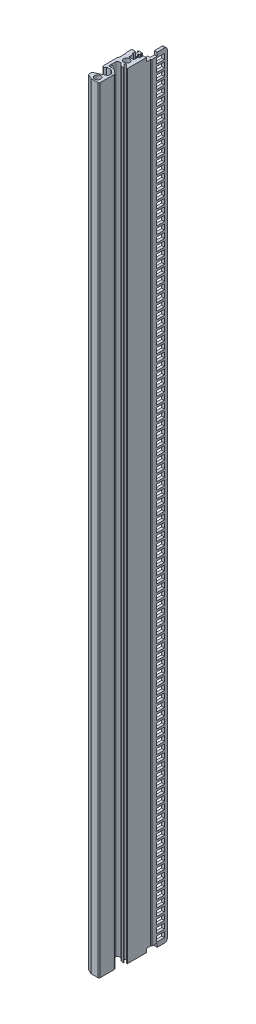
SolidWorks part; units mm, degrees
ref_plane "前视基准面" through (0, 0, 0) normal (0, 0, 1) x (1, 0, 0)
ref_plane "上视基准面" through (0, 0, 0) normal (0, 1, 0) x (1, 0, 0)
ref_plane "右视基准面" through (0, 0, 0) normal (1, 0, 0) x (0, 0, -1)
sketch "草图1" plane through (0, 0, 0) normal (0, 1, 0) x (1, 0, 0)
  line L0 (-4.2, 11.9) -> (-3.9, 11.9)
  line L1 (-4.4, 12.2) -> (-4.4, 12.1)
  line L2 (-4.0328, 12.4) -> (-4.2, 12.4)
  line L3 (-3.85, 12.5) -> (-3.8914, 12.4586)
  line L4 (-2.05, 12.5) -> (-3.85, 12.5)
  line L5 (-2.0086, 12.4586) -> (-2.05, 12.5)
  line L6 (-1.7, 12.4) -> (-1.8672, 12.4)
  line L7 (-1.5, 12.1) -> (-1.5, 12.2)
  line L8 (-1.8, 11.9) -> (-1.7, 11.9)
  line L9 (-2, 11.4828) -> (-2, 11.7)
  line L10 (-1.3586, 10.7586) -> (-1.9414, 11.3414)
  line L11 (-1.3, 10.55) -> (-1.3, 10.6172)
  line L12 (-3.7, 11.7) -> (-3.7, 9.95)
  line L13 (-5, -10.75) -> (-5, -1.6)
  line L14 (-3, -9.35) -> (-3, -5.75)
  line L16 (1.6887, -3.3855) -> (3.2118, -4.9086)
  line L17 (2.5373, -2.537) -> (4.6586, -4.6583)
  line L18 (5, 15) -> (5, 5.1793)
  line L19 (3.6, 15) -> (5, 15)
  line L20 (3.6, 12.5) -> (3.6, 15)
  line L21 (1.95, 12.5) -> (3.6, 12.5)
  line L22 (1.95, 10.55) -> (1.95, 12.5)
  line L23 (2.85, 10.55) -> (1.95, 10.55)
  line L24 (2.85, 9.35) -> (2.85, 10.55)
  line L25 (1.95, 9.35) -> (2.85, 9.35)
  line L26 (1.95, 8.35) -> (1.95, 9.35)
  line L27 (2.85, 8.35) -> (1.95, 8.35)
  line L28 (2.85, 6.05) -> (2.85, 8.35)
  line L29 (1.95, 6.05) -> (2.85, 6.05)
  line L30 (1.95, 3.8856) -> (1.95, 6.05)
  line L31 (-1.45, 6.05) -> (-1.45, 2.9458)
  line L32 (-2.35, 6.05) -> (-1.45, 6.05)
  line L33 (-2.35, 8.35) -> (-2.35, 6.05)
  line L34 (-1.45, 8.35) -> (-2.35, 8.35)
  line L35 (-1.45, 9.35) -> (-1.45, 8.35)
  line L36 (-2.35, 9.35) -> (-1.45, 9.35)
  line L37 (-2.35, 10.55) -> (-2.35, 9.35)
  line L38 (-1.3, 10.55) -> (-2.35, 10.55)
  line L39 (-4.45, 7.7) -> (-4.7, 7.7)
  line L40 (-5, 7.4) -> (-4.7, 7.7)
  line L41 (-5, 4.4) -> (-5, 7.4)
  line L42 (-4.5499, 3.8998) -> (-5, 4.4)
  line L43 (-4.45, 7.7) -> (-4.45, 9.55)
  line L44 (-3.9, 9.75) -> (-4.25, 9.75)
  line L45 (-4.5499, 3.8998) -> (-4.5501, -1.1002)
  line L46 (-5, -1.6) -> (-4.5501, -1.1002)
  line L47 (4.9414, -1.9395) -> (4.6464, -1.6446) construction
  line L48 (5, -2.081) -> (5, -4.5169)
  line L49 (0, 0) -> (0, -5) construction
  line L50 (4.5, -1.291) -> (4.5, 4.3894) construction
  line L53 (-2.5, -5.25) -> (3.0703, -5.25)
  line L54 (2.5373, -2.537) -> (1.6887, -3.3855) construction
  line L55 (5, 5.1793) -> (5, -2.081)
  line L58 (4.9414, 5.0379) -> (4.6464, 4.743) construction
  line L121 (-3, -9.35) -> (4, -9.35)
  line L122 (-4.2, -17.25) -> (2.6, -17.25)
  line L123 (-5, -22.2) -> (-5, -18.05)
  line L124 (-3, -10.75) -> (2.6, -10.75)
  line L125 (4, -9.35) -> (4, -22.2)
  line L126 (3.2, -23) -> (-4.2, -23)
  line L127 (2.6, -10.75) -> (2.6, -17.25)
  circle A0 centre (0, 0) radius 1.6
  arc A1 (-4.4, 12.1) -> (-4.2, 11.9) centre (-4.2, 12.1) ccw
  arc A2 (-4.2, 12.4) -> (-4.4, 12.2) centre (-4.2, 12.2) ccw
  arc A3 (-4.0328, 12.4) -> (-3.8914, 12.4586) centre (-4.0328, 12.6) ccw
  arc A4 (-2.0086, 12.4586) -> (-1.8672, 12.4) centre (-1.8672, 12.6) ccw
  arc A5 (-1.5, 12.2) -> (-1.7, 12.4) centre (-1.7, 12.2) ccw
  arc A6 (-1.7, 11.9) -> (-1.5, 12.1) centre (-1.7, 12.1) ccw
  arc A7 (-1.8, 11.9) -> (-2, 11.7) centre (-1.8, 11.7) ccw
  arc A8 (-2, 11.4828) -> (-1.9414, 11.3414) centre (-1.8, 11.4828) ccw
  arc A9 (-1.3, 10.6172) -> (-1.3586, 10.7586) centre (-1.5, 10.6172) ccw
  arc A11 (3.0703, -5.25) -> (3.2118, -4.9086) centre (3.0703, -5.05) ccw
  arc A12 (-4.25, 9.75) -> (-4.45, 9.55) centre (-4.25, 9.55) ccw
  arc A13 (-3.9, 9.75) -> (-3.7, 9.95) centre (-3.9, 9.95) ccw
  arc A14 (5, -2.081) -> (4.9414, -1.9395) centre (4.8, -2.081) ccw construction
  arc A15 (4.9414, 5.0379) -> (5, 5.1793) centre (4.8, 5.1793) ccw construction
  arc A16 (4.6586, -4.6583) -> (5, -4.5169) centre (4.8, -4.5169) ccw
  arc A17 (2.5373, -2.537) -> (1.6887, -3.3855) centre (2.113, -2.9613) ccw
  arc A18 (0.7125, 2.9142) -> (-1.1719, 2.7616) centre (0, 0) ccw
  arc A19 (-1.45, 2.9458) -> (-1.1719, 2.7616) centre (-1.25, 2.9458) ccw
  arc A20 (0.7125, 2.9142) -> (1.95, 3.8856) centre (0.95, 3.8856) ccw
  arc A21 (-3.7, 11.7) -> (-3.9, 11.9) centre (-3.9, 11.7) ccw
  arc A22 (4.6464, -1.6446) -> (4.5, -1.291) centre (5, -1.291) cw construction
  arc A23 (4.5, 4.3894) -> (4.6464, 4.743) centre (5, 4.3894) cw construction
  arc A29 (-3, -5.75) -> (-2.5, -5.25) centre (-2.5, -5.75) cw
  arc A60 (-5, -22.2) -> (-4.2, -23) centre (-4.2, -22.2) ccw
  circle A61 centre (0, -20) radius 1.6
  arc A62 (-4.2, -17.25) -> (-5, -18.05) centre (-4.2, -18.05) ccw
  arc A63 (-5, -10.75) -> (-3, -10.75) centre (-4, -10.75) ccw
  arc A64 (3.2, -23) -> (4, -22.2) centre (3.2, -22.2) ccw
  dimension "D1" = 3.2
  dimension "D3" = 5.2
  dimension "D4" = 45
  dimension "D5" = 1.2
  dimension "D7" = 0.6
  dimension "D8" = 0.2
  dimension "D10" = 4.1
  dimension "D11" = 1.4
  dimension "D12" = 0.5
  dimension "D13" = 0.5
  dimension "D14" = 1
  dimension "D33" = 3.2
  dimension "D34" = 20
  dimension "D37" = 0.8
  dimension "D38" = 0.8
  dimension "D39" = 0.8
  dimension "D6" = 3
  dimension "D9" = 2.1225
  dimension "D28" = 38
  dimension "D29" = 13.65
  dimension "D30" = 1
  dimension "D31" = 9
  dimension "D32" = 5.75
  dimension "D36" = 6.5
extrude "凸台-拉伸1" add sketch "草图1" along normal mid plane 533.4
sketch "草图6" plane through (0, 266.7, 0) normal (0, 1, 0) x (1, 0, 0)
  line L0 (3.6, 12.5) -> (3.6, 22.5)
  line L1 (3.6, 22.5) -> (5.5, 22.5)
  line L2 (5.5, 22.5) -> (5.5, 12)
  line L3 (5.5, 12) -> (5, 11.5)
  line L4 (3.6, 12.5) -> (5, 11.5)
  line L5 (5, -4.5169) -> (5, 15) construction
  line L6 (-5, 7.4) -> (-5, 4.4) construction
  dimension "D4" = 11
  dimension "D1" = 10.5
  dimension "D2" = 10
  dimension "D3" = 45
extrude "凸台-拉伸2" add sketch "草图6" against normal up to surface (533.4 mm away)
sketch "草图2" plane through (0, 266.7, 0) normal (0, 1, 0) x (1, 0, 0)
  circle A0 centre (0, 0) radius 2.1
  circle A1 centre (0, -20) radius 2.1
  dimension "D1" = 4.2
  dimension "D2" = 4.2
extrude "切除-拉伸1" cut sketch "草图2" against normal blind 10
sketch "草图3" plane through (0, -266.7, 0) normal (0, -1, 0) x (1, 0, 0)
  circle A0 centre (0, 0) radius 2.1
  circle A1 centre (0, 20) radius 2.1
  dimension "D1" = 4.2
  dimension "D2" = 4.2
extrude "切除-拉伸2" cut sketch "草图3" against normal blind 10
sketch "草图4" plane through (-5, 0, 0) normal (-1, 0, 0) x (0, 0, 1)
  line L0 (1.6, -266.7) -> (10.75, -266.7) construction
  line L2 (11.75, -266.7) -> (11.75, 266.7) construction
  circle A0 centre (7.5, -264.16) radius 1.65
  circle A1 centre (7.5, -259.08) radius 1.65
  circle A2 centre (7.5, -254) radius 1.65
  circle A3 centre (7.5, -248.92) radius 1.65
  circle A4 centre (7.5, -243.84) radius 1.65
  circle A5 centre (7.5, -238.76) radius 1.65
  circle A6 centre (7.5, -233.68) radius 1.65
  circle A7 centre (7.5, -228.6) radius 1.65
  circle A8 centre (7.5, -223.52) radius 1.65
  circle A9 centre (7.5, -218.44) radius 1.65
  circle A10 centre (7.5, -213.36) radius 1.65
  circle A11 centre (7.5, -208.28) radius 1.65
  circle A12 centre (7.5, -203.2) radius 1.65
  circle A13 centre (7.5, -198.12) radius 1.65
  circle A14 centre (7.5, -193.04) radius 1.65
  circle A15 centre (7.5, -187.96) radius 1.65
  circle A16 centre (7.5, -182.88) radius 1.65
  circle A17 centre (7.5, -177.8) radius 1.65
  circle A18 centre (7.5, -172.72) radius 1.65
  circle A19 centre (7.5, -167.64) radius 1.65
  circle A20 centre (7.5, -162.56) radius 1.65
  circle A21 centre (7.5, -157.48) radius 1.65
  circle A22 centre (7.5, -152.4) radius 1.65
  circle A23 centre (7.5, -147.32) radius 1.65
  circle A24 centre (7.5, -142.24) radius 1.65
  circle A25 centre (7.5, -137.16) radius 1.65
  circle A26 centre (7.5, -132.08) radius 1.65
  circle A27 centre (7.5, -127) radius 1.65
  circle A28 centre (7.5, -121.92) radius 1.65
  circle A29 centre (7.5, -116.84) radius 1.65
  circle A30 centre (7.5, -111.76) radius 1.65
  circle A31 centre (7.5, -106.68) radius 1.65
  circle A32 centre (7.5, -101.6) radius 1.65
  circle A33 centre (7.5, -96.52) radius 1.65
  circle A34 centre (7.5, -91.44) radius 1.65
  circle A35 centre (7.5, -86.36) radius 1.65
  circle A36 centre (7.5, -81.28) radius 1.65
  circle A37 centre (7.5, -76.2) radius 1.65
  circle A38 centre (7.5, -71.12) radius 1.65
  circle A39 centre (7.5, -66.04) radius 1.65
  circle A40 centre (7.5, -60.96) radius 1.65
  circle A41 centre (7.5, -55.88) radius 1.65
  circle A42 centre (7.5, -50.8) radius 1.65
  circle A43 centre (7.5, -45.72) radius 1.65
  circle A44 centre (7.5, -40.64) radius 1.65
  circle A45 centre (7.5, -35.56) radius 1.65
  circle A46 centre (7.5, -30.48) radius 1.65
  circle A47 centre (7.5, -25.4) radius 1.65
  circle A48 centre (7.5, -20.32) radius 1.65
  circle A49 centre (7.5, -15.24) radius 1.65
  circle A50 centre (7.5, -10.16) radius 1.65
  circle A51 centre (7.5, -5.08) radius 1.65
  circle A52 centre (7.5, 0) radius 1.65
  circle A53 centre (7.5, 5.08) radius 1.65
  circle A54 centre (7.5, 10.16) radius 1.65
  circle A55 centre (7.5, 15.24) radius 1.65
  circle A56 centre (7.5, 20.32) radius 1.65
  circle A57 centre (7.5, 25.4) radius 1.65
  circle A58 centre (7.5, 30.48) radius 1.65
  circle A59 centre (7.5, 35.56) radius 1.65
  circle A60 centre (7.5, 40.64) radius 1.65
  circle A61 centre (7.5, 45.72) radius 1.65
  circle A62 centre (7.5, 50.8) radius 1.65
  circle A63 centre (7.5, 55.88) radius 1.65
  circle A64 centre (7.5, 60.96) radius 1.65
  circle A65 centre (7.5, 66.04) radius 1.65
  circle A66 centre (7.5, 71.12) radius 1.65
  circle A67 centre (7.5, 76.2) radius 1.65
  circle A68 centre (7.5, 81.28) radius 1.65
  circle A69 centre (7.5, 86.36) radius 1.65
  circle A70 centre (7.5, 91.44) radius 1.65
  circle A71 centre (7.5, 96.52) radius 1.65
  circle A72 centre (7.5, 101.6) radius 1.65
  circle A73 centre (7.5, 106.68) radius 1.65
  circle A74 centre (7.5, 111.76) radius 1.65
  circle A75 centre (7.5, 116.84) radius 1.65
  circle A76 centre (7.5, 121.92) radius 1.65
  circle A77 centre (7.5, 127) radius 1.65
  circle A78 centre (7.5, 132.08) radius 1.65
  circle A79 centre (7.5, 137.16) radius 1.65
  circle A80 centre (7.5, 142.24) radius 1.65
  circle A81 centre (7.5, 147.32) radius 1.65
  circle A82 centre (7.5, 152.4) radius 1.65
  circle A83 centre (7.5, 157.48) radius 1.65
  circle A84 centre (7.5, 162.56) radius 1.65
  circle A85 centre (7.5, 203.2) radius 1.65
  circle A86 centre (7.5, 167.64) radius 1.65
  circle A87 centre (7.5, 213.36) radius 1.65
  circle A88 centre (7.5, 172.72) radius 1.65
  circle A89 centre (7.5, 198.12) radius 1.65
  circle A90 centre (7.5, 182.88) radius 1.65
  circle A91 centre (7.5, 218.44) radius 1.65
  circle A92 centre (7.5, 187.96) radius 1.65
  circle A93 centre (7.5, 177.8) radius 1.65
  circle A94 centre (7.5, 208.28) radius 1.65
  circle A95 centre (7.5, 193.04) radius 1.65
  circle A96 centre (7.5, 259.08) radius 1.65
  circle A97 centre (7.5, 223.52) radius 1.65
  circle A99 centre (7.5, 228.6) radius 1.65
  circle A100 centre (7.5, 254) radius 1.65
  circle A101 centre (7.5, 238.76) radius 1.65
  circle A103 centre (7.5, 243.84) radius 1.65
  circle A104 centre (7.5, 233.68) radius 1.65
  circle A105 centre (7.5, 264.16) radius 1.65
  circle A106 centre (7.5, 248.92) radius 1.65
  dimension "D1" = 2.54
  dimension "D2" = 4.25
  dimension "D3" = 3.3
  dimension "D5" = 5.08
  dimension "D4" = 85
extrude "切除-拉伸3" cut sketch "草图4" against normal blind 12
sketch "草图5" plane through (5.5, 0, 0) normal (1, 0, 0) x (0, 0, -1)
  line L0 (-19.1753, 0) -> (41.1348, 0) construction
  line L1 (15.5, 266.7) -> (8.5, 266.7)
  line L2 (15.5, 266.7) -> (15.5, 264.16)
  line L3 (15.5, 264.16) -> (8.5, 264.16)
  line L4 (8.5, 266.7) -> (8.5, 264.16)
  line L6 (8.5, -266.7) -> (8.5, -264.16)
  line L7 (15.5, -264.16) -> (8.5, -264.16)
  line L8 (15.5, -266.7) -> (15.5, -264.16)
  line L9 (15.5, -266.7) -> (8.5, -266.7)
  line L10 (12, 266.7) -> (22.5, 266.7) construction
  line L11 (22.5, -266.7) -> (22.5, 266.7) construction
  dimension "D1" = 7
  dimension "D2" = 2.54
  dimension "D3" = 7
extrude "切除-拉伸4" cut sketch "草图5" against normal through all
sketch "草图7" plane through (5.5, 0, 0) normal (1, 0, 0) x (0, 0, -1)
  line L0 (22.5, -266.7) -> (22.5, 266.7) construction
  line L1 (15, -263.42) -> (20.5, -263.42)
  line L2 (15, -263.42) -> (15, -259.82)
  line L3 (15, -259.82) -> (20.5, -259.82)
  line L4 (20.5, -263.42) -> (20.5, -259.82)
  line L5 (22.5, -266.7) -> (15.5, -266.7) construction
  line L6 (15, -258.34) -> (20.5, -258.34)
  line L7 (15, -258.34) -> (15, -254.74)
  line L8 (15, -254.74) -> (20.5, -254.74)
  line L9 (20.5, -258.34) -> (20.5, -254.74)
  line L10 (15, -253.26) -> (20.5, -253.26)
  line L11 (15, -253.26) -> (15, -249.66)
  line L12 (15, -249.66) -> (20.5, -249.66)
  line L13 (20.5, -253.26) -> (20.5, -249.66)
  line L14 (15, -248.18) -> (20.5, -248.18)
  line L15 (15, -248.18) -> (15, -244.58)
  line L16 (15, -244.58) -> (20.5, -244.58)
  line L17 (20.5, -248.18) -> (20.5, -244.58)
  line L18 (15, -243.1) -> (20.5, -243.1)
  line L19 (15, -243.1) -> (15, -239.5)
  line L20 (15, -239.5) -> (20.5, -239.5)
  line L21 (20.5, -243.1) -> (20.5, -239.5)
  line L22 (15, -238.02) -> (20.5, -238.02)
  line L23 (15, -238.02) -> (15, -234.42)
  line L24 (15, -234.42) -> (20.5, -234.42)
  line L25 (20.5, -238.02) -> (20.5, -234.42)
  line L26 (15, -232.94) -> (20.5, -232.94)
  line L27 (15, -232.94) -> (15, -229.34)
  line L28 (15, -229.34) -> (20.5, -229.34)
  line L29 (20.5, -232.94) -> (20.5, -229.34)
  line L30 (15, -227.86) -> (20.5, -227.86)
  line L31 (15, -227.86) -> (15, -224.26)
  line L32 (15, -224.26) -> (20.5, -224.26)
  line L33 (20.5, -227.86) -> (20.5, -224.26)
  line L34 (15, -222.78) -> (20.5, -222.78)
  line L35 (15, -222.78) -> (15, -219.18)
  line L36 (15, -219.18) -> (20.5, -219.18)
  line L37 (20.5, -222.78) -> (20.5, -219.18)
  line L38 (15, -217.7) -> (20.5, -217.7)
  line L39 (15, -217.7) -> (15, -214.1)
  line L40 (15, -214.1) -> (20.5, -214.1)
  line L41 (20.5, -217.7) -> (20.5, -214.1)
  line L42 (15, -212.62) -> (20.5, -212.62)
  line L43 (15, -212.62) -> (15, -209.02)
  line L44 (15, -209.02) -> (20.5, -209.02)
  line L45 (20.5, -212.62) -> (20.5, -209.02)
  line L46 (15, -207.54) -> (20.5, -207.54)
  line L47 (15, -207.54) -> (15, -203.94)
  line L48 (15, -203.94) -> (20.5, -203.94)
  line L49 (20.5, -207.54) -> (20.5, -203.94)
  line L50 (15, -202.46) -> (20.5, -202.46)
  line L51 (15, -202.46) -> (15, -198.86)
  line L52 (15, -198.86) -> (20.5, -198.86)
  line L53 (20.5, -202.46) -> (20.5, -198.86)
  line L54 (15, -197.38) -> (20.5, -197.38)
  line L55 (15, -197.38) -> (15, -193.78)
  line L56 (15, -193.78) -> (20.5, -193.78)
  line L57 (20.5, -197.38) -> (20.5, -193.78)
  line L58 (15, -192.3) -> (20.5, -192.3)
  line L59 (15, -192.3) -> (15, -188.7)
  line L60 (15, -188.7) -> (20.5, -188.7)
  line L61 (20.5, -192.3) -> (20.5, -188.7)
  line L62 (15, -187.22) -> (20.5, -187.22)
  line L63 (15, -187.22) -> (15, -183.62)
  line L64 (15, -183.62) -> (20.5, -183.62)
  line L65 (20.5, -187.22) -> (20.5, -183.62)
  line L66 (15, -182.14) -> (20.5, -182.14)
  line L67 (15, -182.14) -> (15, -178.54)
  line L68 (15, -178.54) -> (20.5, -178.54)
  line L69 (20.5, -182.14) -> (20.5, -178.54)
  line L70 (15, -177.06) -> (20.5, -177.06)
  line L71 (15, -177.06) -> (15, -173.46)
  line L72 (15, -173.46) -> (20.5, -173.46)
  line L73 (20.5, -177.06) -> (20.5, -173.46)
  line L74 (15, -171.98) -> (20.5, -171.98)
  line L75 (15, -171.98) -> (15, -168.38)
  line L76 (15, -168.38) -> (20.5, -168.38)
  line L77 (20.5, -171.98) -> (20.5, -168.38)
  line L78 (15, -166.9) -> (20.5, -166.9)
  line L79 (15, -166.9) -> (15, -163.3)
  line L80 (15, -163.3) -> (20.5, -163.3)
  line L81 (20.5, -166.9) -> (20.5, -163.3)
  line L82 (15, -161.82) -> (20.5, -161.82)
  line L83 (15, -161.82) -> (15, -158.22)
  line L84 (15, -158.22) -> (20.5, -158.22)
  line L85 (20.5, -161.82) -> (20.5, -158.22)
  line L86 (15, -156.74) -> (20.5, -156.74)
  line L87 (15, -156.74) -> (15, -153.14)
  line L88 (15, -153.14) -> (20.5, -153.14)
  line L89 (20.5, -156.74) -> (20.5, -153.14)
  line L90 (15, -151.66) -> (20.5, -151.66)
  line L91 (15, -151.66) -> (15, -148.06)
  line L92 (15, -148.06) -> (20.5, -148.06)
  line L93 (20.5, -151.66) -> (20.5, -148.06)
  line L94 (15, -146.58) -> (20.5, -146.58)
  line L95 (15, -146.58) -> (15, -142.98)
  line L96 (15, -142.98) -> (20.5, -142.98)
  line L97 (20.5, -146.58) -> (20.5, -142.98)
  line L98 (15, -141.5) -> (20.5, -141.5)
  line L99 (15, -141.5) -> (15, -137.9)
  line L100 (15, -137.9) -> (20.5, -137.9)
  line L101 (20.5, -141.5) -> (20.5, -137.9)
  line L102 (15, -136.42) -> (20.5, -136.42)
  line L103 (15, -136.42) -> (15, -132.82)
  line L104 (15, -132.82) -> (20.5, -132.82)
  line L105 (20.5, -136.42) -> (20.5, -132.82)
  line L106 (15, -131.34) -> (20.5, -131.34)
  line L107 (15, -131.34) -> (15, -127.74)
  line L108 (15, -127.74) -> (20.5, -127.74)
  line L109 (20.5, -131.34) -> (20.5, -127.74)
  line L110 (15, -126.26) -> (20.5, -126.26)
  line L111 (15, -126.26) -> (15, -122.66)
  line L112 (15, -122.66) -> (20.5, -122.66)
  line L113 (20.5, -126.26) -> (20.5, -122.66)
  line L114 (15, -121.18) -> (20.5, -121.18)
  line L115 (15, -121.18) -> (15, -117.58)
  line L116 (15, -117.58) -> (20.5, -117.58)
  line L117 (20.5, -121.18) -> (20.5, -117.58)
  line L118 (15, -116.1) -> (20.5, -116.1)
  line L119 (15, -116.1) -> (15, -112.5)
  line L120 (15, -112.5) -> (20.5, -112.5)
  line L121 (20.5, -116.1) -> (20.5, -112.5)
  line L122 (15, -111.02) -> (20.5, -111.02)
  line L123 (15, -111.02) -> (15, -107.42)
  line L124 (15, -107.42) -> (20.5, -107.42)
  line L125 (20.5, -111.02) -> (20.5, -107.42)
  line L126 (15, -105.94) -> (20.5, -105.94)
  line L127 (15, -105.94) -> (15, -102.34)
  line L128 (15, -102.34) -> (20.5, -102.34)
  line L129 (20.5, -105.94) -> (20.5, -102.34)
  line L130 (15, -100.86) -> (20.5, -100.86)
  line L131 (15, -100.86) -> (15, -97.26)
  line L132 (15, -97.26) -> (20.5, -97.26)
  line L133 (20.5, -100.86) -> (20.5, -97.26)
  line L134 (15, -95.78) -> (20.5, -95.78)
  line L135 (15, -95.78) -> (15, -92.18)
  line L136 (15, -92.18) -> (20.5, -92.18)
  line L137 (20.5, -95.78) -> (20.5, -92.18)
  line L138 (15, -90.7) -> (20.5, -90.7)
  line L139 (15, -90.7) -> (15, -87.1)
  line L140 (15, -87.1) -> (20.5, -87.1)
  line L141 (20.5, -90.7) -> (20.5, -87.1)
  line L142 (15, -85.62) -> (20.5, -85.62)
  line L143 (15, -85.62) -> (15, -82.02)
  line L144 (15, -82.02) -> (20.5, -82.02)
  line L145 (20.5, -85.62) -> (20.5, -82.02)
  line L146 (15, -80.54) -> (20.5, -80.54)
  line L147 (15, -80.54) -> (15, -76.94)
  line L148 (15, -76.94) -> (20.5, -76.94)
  line L149 (20.5, -80.54) -> (20.5, -76.94)
  line L150 (15, -75.46) -> (20.5, -75.46)
  line L151 (15, -75.46) -> (15, -71.86)
  line L152 (15, -71.86) -> (20.5, -71.86)
  line L153 (20.5, -75.46) -> (20.5, -71.86)
  line L154 (15, -70.38) -> (20.5, -70.38)
  line L155 (15, -70.38) -> (15, -66.78)
  line L156 (15, -66.78) -> (20.5, -66.78)
  line L157 (20.5, -70.38) -> (20.5, -66.78)
  line L158 (15, -65.3) -> (20.5, -65.3)
  line L159 (15, -65.3) -> (15, -61.7)
  line L160 (15, -61.7) -> (20.5, -61.7)
  line L161 (20.5, -65.3) -> (20.5, -61.7)
  line L162 (15, -60.22) -> (20.5, -60.22)
  line L163 (15, -60.22) -> (15, -56.62)
  line L164 (15, -56.62) -> (20.5, -56.62)
  line L165 (20.5, -60.22) -> (20.5, -56.62)
  line L166 (15, -55.14) -> (20.5, -55.14)
  line L167 (15, -55.14) -> (15, -51.54)
  line L168 (15, -51.54) -> (20.5, -51.54)
  line L169 (20.5, -55.14) -> (20.5, -51.54)
  line L170 (15, -50.06) -> (20.5, -50.06)
  line L171 (15, -50.06) -> (15, -46.46)
  line L172 (15, -46.46) -> (20.5, -46.46)
  line L173 (20.5, -50.06) -> (20.5, -46.46)
  line L174 (15, -44.98) -> (20.5, -44.98)
  line L175 (15, -44.98) -> (15, -41.38)
  line L176 (15, -41.38) -> (20.5, -41.38)
  line L177 (20.5, -44.98) -> (20.5, -41.38)
  line L178 (15, -39.9) -> (20.5, -39.9)
  line L179 (15, -39.9) -> (15, -36.3)
  line L180 (15, -36.3) -> (20.5, -36.3)
  line L181 (20.5, -39.9) -> (20.5, -36.3)
  line L182 (15, -34.82) -> (20.5, -34.82)
  line L183 (15, -34.82) -> (15, -31.22)
  line L184 (15, -31.22) -> (20.5, -31.22)
  line L185 (20.5, -34.82) -> (20.5, -31.22)
  line L186 (15, -29.74) -> (20.5, -29.74)
  line L187 (15, -29.74) -> (15, -26.14)
  line L188 (15, -26.14) -> (20.5, -26.14)
  line L189 (20.5, -29.74) -> (20.5, -26.14)
  line L190 (15, -24.66) -> (20.5, -24.66)
  line L191 (15, -24.66) -> (15, -21.06)
  line L192 (15, -21.06) -> (20.5, -21.06)
  line L193 (20.5, -24.66) -> (20.5, -21.06)
  line L194 (15, -19.58) -> (20.5, -19.58)
  line L195 (15, -19.58) -> (15, -15.98)
  line L196 (15, -15.98) -> (20.5, -15.98)
  line L197 (20.5, -19.58) -> (20.5, -15.98)
  line L198 (15, -14.5) -> (20.5, -14.5)
  line L199 (15, -14.5) -> (15, -10.9)
  line L200 (15, -10.9) -> (20.5, -10.9)
  line L201 (20.5, -14.5) -> (20.5, -10.9)
  line L202 (15, -9.42) -> (20.5, -9.42)
  line L203 (15, -9.42) -> (15, -5.82)
  line L204 (15, -5.82) -> (20.5, -5.82)
  line L205 (20.5, -9.42) -> (20.5, -5.82)
  line L206 (15, -4.34) -> (20.5, -4.34)
  line L207 (15, -4.34) -> (15, -0.74)
  line L208 (15, -0.74) -> (20.5, -0.74)
  line L209 (20.5, -4.34) -> (20.5, -0.74)
  line L210 (15, 0.74) -> (20.5, 0.74)
  line L211 (15, 0.74) -> (15, 4.34)
  line L212 (15, 4.34) -> (20.5, 4.34)
  line L213 (20.5, 0.74) -> (20.5, 4.34)
  line L214 (15, 5.82) -> (20.5, 5.82)
  line L215 (15, 5.82) -> (15, 9.42)
  line L216 (15, 9.42) -> (20.5, 9.42)
  line L217 (20.5, 5.82) -> (20.5, 9.42)
  line L218 (15, 10.9) -> (20.5, 10.9)
  line L219 (15, 10.9) -> (15, 14.5)
  line L220 (15, 14.5) -> (20.5, 14.5)
  line L221 (20.5, 10.9) -> (20.5, 14.5)
  line L222 (15, 15.98) -> (20.5, 15.98)
  line L223 (15, 15.98) -> (15, 19.58)
  line L224 (15, 19.58) -> (20.5, 19.58)
  line L225 (20.5, 15.98) -> (20.5, 19.58)
  line L226 (15, 21.06) -> (20.5, 21.06)
  line L227 (15, 21.06) -> (15, 24.66)
  line L228 (15, 24.66) -> (20.5, 24.66)
  line L229 (20.5, 21.06) -> (20.5, 24.66)
  line L230 (15, 26.14) -> (20.5, 26.14)
  line L231 (15, 26.14) -> (15, 29.74)
  line L232 (15, 29.74) -> (20.5, 29.74)
  line L233 (20.5, 26.14) -> (20.5, 29.74)
  line L234 (15, 31.22) -> (20.5, 31.22)
  line L235 (15, 31.22) -> (15, 34.82)
  line L236 (15, 34.82) -> (20.5, 34.82)
  line L237 (20.5, 31.22) -> (20.5, 34.82)
  line L238 (15, 36.3) -> (20.5, 36.3)
  line L239 (15, 36.3) -> (15, 39.9)
  line L240 (15, 39.9) -> (20.5, 39.9)
  line L241 (20.5, 36.3) -> (20.5, 39.9)
  line L242 (15, 41.38) -> (20.5, 41.38)
  line L243 (15, 41.38) -> (15, 44.98)
  line L244 (15, 44.98) -> (20.5, 44.98)
  line L245 (20.5, 41.38) -> (20.5, 44.98)
  line L246 (15, 46.46) -> (20.5, 46.46)
  line L247 (15, 46.46) -> (15, 50.06)
  line L248 (15, 50.06) -> (20.5, 50.06)
  line L249 (20.5, 46.46) -> (20.5, 50.06)
  line L250 (15, 51.54) -> (20.5, 51.54)
  line L251 (15, 51.54) -> (15, 55.14)
  line L252 (15, 55.14) -> (20.5, 55.14)
  line L253 (20.5, 51.54) -> (20.5, 55.14)
  line L254 (15, 56.62) -> (20.5, 56.62)
  line L255 (15, 56.62) -> (15, 60.22)
  line L256 (15, 60.22) -> (20.5, 60.22)
  line L257 (20.5, 56.62) -> (20.5, 60.22)
  line L258 (15, 61.7) -> (20.5, 61.7)
  line L259 (15, 61.7) -> (15, 65.3)
  line L260 (15, 65.3) -> (20.5, 65.3)
  line L261 (20.5, 61.7) -> (20.5, 65.3)
  line L262 (15, 66.78) -> (20.5, 66.78)
  line L263 (15, 66.78) -> (15, 70.38)
  line L264 (15, 70.38) -> (20.5, 70.38)
  line L265 (20.5, 66.78) -> (20.5, 70.38)
  line L266 (15, 71.86) -> (20.5, 71.86)
  line L267 (15, 71.86) -> (15, 75.46)
  line L268 (15, 75.46) -> (20.5, 75.46)
  line L269 (20.5, 71.86) -> (20.5, 75.46)
  line L270 (15, 76.94) -> (20.5, 76.94)
  line L271 (15, 76.94) -> (15, 80.54)
  line L272 (15, 80.54) -> (20.5, 80.54)
  line L273 (20.5, 76.94) -> (20.5, 80.54)
  line L274 (15, 82.02) -> (20.5, 82.02)
  line L275 (15, 82.02) -> (15, 85.62)
  line L276 (15, 85.62) -> (20.5, 85.62)
  line L277 (20.5, 82.02) -> (20.5, 85.62)
  line L278 (15, 87.1) -> (20.5, 87.1)
  line L279 (15, 87.1) -> (15, 90.7)
  line L280 (15, 90.7) -> (20.5, 90.7)
  line L281 (20.5, 87.1) -> (20.5, 90.7)
  line L282 (15, 92.18) -> (20.5, 92.18)
  line L283 (15, 92.18) -> (15, 95.78)
  line L284 (15, 95.78) -> (20.5, 95.78)
  line L285 (20.5, 92.18) -> (20.5, 95.78)
  line L286 (15, 97.26) -> (20.5, 97.26)
  line L287 (15, 97.26) -> (15, 100.86)
  line L288 (15, 100.86) -> (20.5, 100.86)
  line L289 (20.5, 97.26) -> (20.5, 100.86)
  line L290 (15, 102.34) -> (20.5, 102.34)
  line L291 (15, 102.34) -> (15, 105.94)
  line L292 (15, 105.94) -> (20.5, 105.94)
  line L293 (20.5, 102.34) -> (20.5, 105.94)
  line L294 (15, 107.42) -> (20.5, 107.42)
  line L295 (15, 107.42) -> (15, 111.02)
  line L296 (15, 111.02) -> (20.5, 111.02)
  line L297 (20.5, 107.42) -> (20.5, 111.02)
  line L298 (15, 112.5) -> (20.5, 112.5)
  line L299 (15, 112.5) -> (15, 116.1)
  line L300 (15, 116.1) -> (20.5, 116.1)
  line L301 (20.5, 112.5) -> (20.5, 116.1)
  line L302 (15, 117.58) -> (20.5, 117.58)
  line L303 (15, 117.58) -> (15, 121.18)
  line L304 (15, 121.18) -> (20.5, 121.18)
  line L305 (20.5, 117.58) -> (20.5, 121.18)
  line L306 (15, 122.66) -> (20.5, 122.66)
  line L307 (15, 122.66) -> (15, 126.26)
  line L308 (15, 126.26) -> (20.5, 126.26)
  line L309 (20.5, 122.66) -> (20.5, 126.26)
  line L310 (15, 127.74) -> (20.5, 127.74)
  line L311 (15, 127.74) -> (15, 131.34)
  line L312 (15, 131.34) -> (20.5, 131.34)
  line L313 (20.5, 127.74) -> (20.5, 131.34)
  line L314 (15, 132.82) -> (20.5, 132.82)
  line L315 (15, 132.82) -> (15, 136.42)
  line L316 (15, 136.42) -> (20.5, 136.42)
  line L317 (20.5, 132.82) -> (20.5, 136.42)
  line L318 (15, 137.9) -> (20.5, 137.9)
  line L319 (15, 137.9) -> (15, 141.5)
  line L320 (15, 141.5) -> (20.5, 141.5)
  line L321 (20.5, 137.9) -> (20.5, 141.5)
  line L322 (15, 142.98) -> (20.5, 142.98)
  line L323 (15, 142.98) -> (15, 146.58)
  line L324 (15, 146.58) -> (20.5, 146.58)
  line L325 (20.5, 142.98) -> (20.5, 146.58)
  line L326 (15, 148.06) -> (20.5, 148.06)
  line L327 (15, 148.06) -> (15, 151.66)
  line L328 (15, 151.66) -> (20.5, 151.66)
  line L329 (20.5, 148.06) -> (20.5, 151.66)
  line L330 (15, 153.14) -> (20.5, 153.14)
  line L331 (15, 153.14) -> (15, 156.74)
  line L332 (15, 156.74) -> (20.5, 156.74)
  line L333 (20.5, 153.14) -> (20.5, 156.74)
  line L334 (15, 158.22) -> (20.5, 158.22)
  line L335 (15, 158.22) -> (15, 161.82)
  line L336 (15, 161.82) -> (20.5, 161.82)
  line L337 (20.5, 158.22) -> (20.5, 161.82)
  line L338 (15, 197.38) -> (20.5, 197.38)
  line L339 (15, 217.7) -> (20.5, 217.7)
  line L340 (15, 163.3) -> (20.5, 163.3)
  line L341 (15, 203.94) -> (15, 207.54)
  line L342 (20.5, 214.1) -> (20.5, 217.7)
  line L343 (15, 227.86) -> (20.5, 227.86)
  line L344 (15, 209.02) -> (15, 212.62)
  line L345 (15, 222.78) -> (20.5, 222.78)
  line L346 (15, 173.46) -> (15, 177.06)
  line L347 (15, 187.22) -> (20.5, 187.22)
  line L348 (20.5, 198.86) -> (20.5, 202.46)
  line L349 (15, 212.62) -> (20.5, 212.62)
  line L350 (15, 163.3) -> (15, 166.9)
  line L351 (15, 182.14) -> (20.5, 182.14)
  line L352 (20.5, 193.78) -> (20.5, 197.38)
  line L353 (15, 168.38) -> (20.5, 168.38)
  line L354 (15, 198.86) -> (20.5, 198.86)
  line L355 (20.5, 224.26) -> (20.5, 227.86)
  line L356 (15, 177.06) -> (20.5, 177.06)
  line L357 (15, 219.18) -> (20.5, 219.18)
  line L358 (15, 183.62) -> (20.5, 183.62)
  line L359 (15, 193.78) -> (15, 197.38)
  line L360 (20.5, 209.02) -> (20.5, 212.62)
  line L361 (15, 214.1) -> (15, 217.7)
  line L362 (20.5, 219.18) -> (20.5, 222.78)
  line L363 (15, 166.9) -> (20.5, 166.9)
  line L364 (20.5, 183.62) -> (20.5, 187.22)
  line L365 (15, 203.94) -> (20.5, 203.94)
  line L366 (15, 168.38) -> (15, 171.98)
  line L367 (20.5, 178.54) -> (20.5, 182.14)
  line L368 (15, 188.7) -> (15, 192.3)
  line L369 (15, 198.86) -> (15, 202.46)
  line L370 (15, 171.98) -> (20.5, 171.98)
  line L371 (20.5, 188.7) -> (20.5, 192.3)
  line L372 (15, 193.78) -> (20.5, 193.78)
  line L373 (15, 207.54) -> (20.5, 207.54)
  line L374 (20.5, 163.3) -> (20.5, 166.9)
  line L375 (15, 214.1) -> (20.5, 214.1)
  line L376 (15, 224.26) -> (20.5, 224.26)
  line L377 (15, 224.26) -> (15, 227.86)
  line L378 (15, 188.7) -> (20.5, 188.7)
  line L379 (15, 173.46) -> (20.5, 173.46)
  line L380 (15, 183.62) -> (15, 187.22)
  line L381 (15, 192.3) -> (20.5, 192.3)
  line L382 (20.5, 203.94) -> (20.5, 207.54)
  line L383 (15, 219.18) -> (15, 222.78)
  line L384 (20.5, 168.38) -> (20.5, 171.98)
  line L385 (15, 178.54) -> (15, 182.14)
  line L386 (15, 202.46) -> (20.5, 202.46)
  line L387 (15, 209.02) -> (20.5, 209.02)
  line L388 (20.5, 173.46) -> (20.5, 177.06)
  line L389 (15, 178.54) -> (20.5, 178.54)
  line L390 (15, 263.42) -> (20.5, 263.42)
  line L392 (15, 229.34) -> (20.5, 229.34)
  line L398 (15, 239.5) -> (15, 243.1)
  line L399 (15, 253.26) -> (20.5, 253.26)
  line L402 (15, 229.34) -> (15, 232.94)
  line L403 (15, 248.18) -> (20.5, 248.18)
  line L404 (20.5, 259.82) -> (20.5, 263.42)
  line L405 (15, 234.42) -> (20.5, 234.42)
  line L408 (15, 243.1) -> (20.5, 243.1)
  line L410 (15, 249.66) -> (20.5, 249.66)
  line L411 (15, 259.82) -> (15, 263.42)
  line L415 (15, 232.94) -> (20.5, 232.94)
  line L416 (20.5, 249.66) -> (20.5, 253.26)
  line L418 (15, 234.42) -> (15, 238.02)
  line L419 (20.5, 244.58) -> (20.5, 248.18)
  line L420 (15, 254.74) -> (15, 258.34)
  line L422 (15, 238.02) -> (20.5, 238.02)
  line L423 (20.5, 254.74) -> (20.5, 258.34)
  line L424 (15, 259.82) -> (20.5, 259.82)
  line L426 (20.5, 229.34) -> (20.5, 232.94)
  line L430 (15, 254.74) -> (20.5, 254.74)
  line L431 (15, 239.5) -> (20.5, 239.5)
  line L432 (15, 249.66) -> (15, 253.26)
  line L433 (15, 258.34) -> (20.5, 258.34)
  line L436 (20.5, 234.42) -> (20.5, 238.02)
  line L437 (15, 244.58) -> (15, 248.18)
  line L440 (20.5, 239.5) -> (20.5, 243.1)
  line L441 (15, 244.58) -> (20.5, 244.58)
  dimension "D1" = 3.6
  dimension "D2" = 5.5
  dimension "D3" = 2
  dimension "D4" = 3.28
  dimension "D5" = 84
extrude "切除-拉伸5" cut sketch "草图7" against normal blind 10
fillet "圆角1" radius 2 2 edges at (4.55, 266.7, -22.5) (4.55, -266.7, -22.5)
sketch "草图8" plane through (0, -266.7, 0) normal (0, -1, 0) x (1, 0, 0)
  line L0 (-4.45, -8.5) -> (-5, -8.5)
  line L1 (-4.45, -8.5) -> (-4.45, -7.7)
  line L3 (-4.45, -7.7) -> (-4.7, -7.7)
  line L4 (-4.7, -7.7) -> (-5, -7.4)
  line L5 (-5, -7.4) -> (-5, -8.5)
extrude "凸台-拉伸3" add sketch "草图8" against normal through all
chamfer "倒角1" distance 0.55 angle 45 1 edges at (-5, 0, -8.5)
sketch "草图9" plane through (0, 0, -8.5) normal (0, 0, -1) x (-1, 0, 0)
  line L0 (4.45, 264.16) -> (1.45, 264.16) construction
  line L1 (1.45, 266.7) -> (2.35, 266.7)
  line L2 (1.45, 266.7) -> (1.45, 264.16)
  line L3 (1.45, 264.16) -> (2.35, 264.16)
  line L4 (2.35, 266.7) -> (2.35, 264.16)
  line L5 (2.35, 266.7) -> (2.35, -266.7) construction
  line L6 (-1.95, 264.16) -> (-5, 264.16) construction
  line L7 (-1.95, 266.7) -> (-2.85, 266.7)
  line L8 (-1.95, 266.7) -> (-1.95, 264.16)
  line L9 (-1.95, 264.16) -> (-2.85, 264.16)
  line L10 (-2.85, 266.7) -> (-2.85, 264.16)
  line L11 (-2.85, 266.7) -> (-2.85, -266.7) construction
  line L12 (5, 0) -> (-5.5, 0) construction
  line L13 (5, 266.7) -> (5, -266.7) construction
  line L14 (-5.5, -264.7) -> (-5.5, 264.7) construction
  line L15 (-2.85, -266.7) -> (-2.85, -264.16)
  line L16 (-1.95, -264.16) -> (-2.85, -264.16)
  line L17 (-1.95, -266.7) -> (-1.95, -264.16)
  line L18 (-1.95, -266.7) -> (-2.85, -266.7)
  line L19 (2.35, -266.7) -> (2.35, -264.16)
  line L20 (1.45, -264.16) -> (2.35, -264.16)
  line L21 (1.45, -266.7) -> (1.45, -264.16)
  line L22 (1.45, -266.7) -> (2.35, -266.7)
extrude "切除-拉伸6" cut sketch "草图9" against normal up to surface (0.15 mm away)
sketch "草图10" plane through (0, 266.7, 0) normal (0, 1, 0) x (1, 0, 0)
  line L0 (-5, -19.75) -> (-1, -23)
  line L1 (-5, -18.05) -> (-5, -22.2) construction
  line L2 (-4.2, -23) -> (3.2, -23) construction
  line L3 (-1, -23) -> (-5, -23)
  line L4 (-5, -23) -> (-5, -19.75)
  line L5 (2.6, -17.25) -> (-4.2, -17.25) construction
  dimension "D1" = 2.5
  dimension "D2" = 4
extrude "切除-拉伸7" [suppressed] cut sketch "草图10" against normal through all
fillet "圆角2" [suppressed] radius 0.8
sketch "草图11" plane through (-5, 0, 0) normal (-1, 0, 0) x (0, 0, 1)
  line L0 (-4.4, 266.7) -> (-4.4, -266.7) construction
  line L1 (-4.4, 223.77) -> (-7.95, 223.77)
  line L2 (-4.4, 223.77) -> (-4.4, 223.27)
  line L3 (-4.4, 223.27) -> (-7.95, 223.27)
  line L4 (-7.95, 223.77) -> (-7.95, 223.27)
  line L5 (-4.4, 223.77) -> (-7.95, 223.27) construction
  line L6 (-4.4, 223.27) -> (-7.95, 223.77) construction
  line L7 (-7.95, 266.7) -> (-7.95, -266.7) construction
  line L8 (-9.95, 264.16) -> (-11.7, 264.16) construction
  line L9 (-4.4, 183.13) -> (-4.4, 182.63)
  line L10 (-4.4, 183.13) -> (-7.95, 183.13)
  line L11 (-4.4, 182.63) -> (-7.95, 183.13) construction
  line L12 (-4.4, 183.13) -> (-7.95, 182.63) construction
  line L13 (-4.4, 182.63) -> (-7.95, 182.63)
  line L14 (-7.95, 183.13) -> (-7.95, 182.63)
  line L15 (-4.4, 142.49) -> (-4.4, 141.99)
  line L16 (-4.4, 142.49) -> (-7.95, 142.49)
  line L17 (-4.4, 141.99) -> (-7.95, 142.49) construction
  line L18 (-4.4, 142.49) -> (-7.95, 141.99) construction
  line L19 (-4.4, 141.99) -> (-7.95, 141.99)
  line L20 (-7.95, 142.49) -> (-7.95, 141.99)
  line L21 (-4.4, 101.85) -> (-4.4, 101.35)
  line L22 (-4.4, 101.85) -> (-7.95, 101.85)
  line L23 (-4.4, 101.35) -> (-7.95, 101.85) construction
  line L24 (-4.4, 101.85) -> (-7.95, 101.35) construction
  line L25 (-4.4, 101.35) -> (-7.95, 101.35)
  line L26 (-7.95, 101.85) -> (-7.95, 101.35)
  line L27 (-4.4, 61.21) -> (-4.4, 60.71)
  line L28 (-4.4, 61.21) -> (-7.95, 61.21)
  line L29 (-4.4, 60.71) -> (-7.95, 61.21) construction
  line L30 (-4.4, 61.21) -> (-7.95, 60.71) construction
  line L31 (-4.4, 60.71) -> (-7.95, 60.71)
  line L32 (-7.95, 61.21) -> (-7.95, 60.71)
  line L33 (-4.4, 20.57) -> (-4.4, 20.07)
  line L34 (-4.4, 20.57) -> (-7.95, 20.57)
  line L35 (-4.4, 20.07) -> (-7.95, 20.57) construction
  line L36 (-4.4, 20.57) -> (-7.95, 20.07) construction
  line L37 (-4.4, 20.07) -> (-7.95, 20.07)
  line L38 (-7.95, 20.57) -> (-7.95, 20.07)
  line L39 (-4.4, -20.07) -> (-4.4, -20.57)
  line L40 (-4.4, -20.07) -> (-7.95, -20.07)
  line L41 (-4.4, -20.57) -> (-7.95, -20.07) construction
  line L42 (-4.4, -20.07) -> (-7.95, -20.57) construction
  line L43 (-4.4, -20.57) -> (-7.95, -20.57)
  line L44 (-7.95, -20.07) -> (-7.95, -20.57)
  line L45 (-4.4, -60.71) -> (-4.4, -61.21)
  line L46 (-4.4, -60.71) -> (-7.95, -60.71)
  line L47 (-4.4, -61.21) -> (-7.95, -60.71) construction
  line L48 (-4.4, -60.71) -> (-7.95, -61.21) construction
  line L49 (-4.4, -61.21) -> (-7.95, -61.21)
  line L50 (-7.95, -60.71) -> (-7.95, -61.21)
  line L51 (-4.4, -101.35) -> (-4.4, -101.85)
  line L52 (-4.4, -101.35) -> (-7.95, -101.35)
  line L53 (-4.4, -101.85) -> (-7.95, -101.35) construction
  line L54 (-4.4, -101.35) -> (-7.95, -101.85) construction
  line L55 (-4.4, -101.85) -> (-7.95, -101.85)
  line L56 (-7.95, -101.35) -> (-7.95, -101.85)
  line L57 (-4.4, -141.99) -> (-4.4, -142.49)
  line L58 (-4.4, -141.99) -> (-7.95, -141.99)
  line L59 (-4.4, -142.49) -> (-7.95, -141.99) construction
  line L60 (-4.4, -141.99) -> (-7.95, -142.49) construction
  line L61 (-4.4, -142.49) -> (-7.95, -142.49)
  line L62 (-7.95, -141.99) -> (-7.95, -142.49)
  point P0 (-6.175, 223.52)
  point P13 (-6.175, 182.88)
  point P18 (-6.175, 142.24)
  point P23 (-6.175, 101.6)
  point P28 (-6.175, 60.96)
  point P33 (-6.175, 20.32)
  point P38 (-6.175, -20.32)
  point P43 (-6.175, -60.96)
  point P48 (-6.175, -101.6)
  point P53 (-6.175, -142.24)
  dimension "D1" = 40.64
  dimension "D2" = 0.5
  dimension "D3" = 10
extrude "切除-拉伸8" [suppressed] cut sketch "草图11" against normal blind 0.01
sketch "草图12" [suppressed] plane through (-5, 0, 0) normal (-1, 0, 0) x (0, 0, 1)
  line L0 (-7.75, 213.36) -> (-7.75, 172.97) construction
  line L1 (-7.95, 50.55) -> (-7.95, 10.41) construction
  line L2 (-4.4, 172.97) -> (-7.95, 172.97) construction
  line L4 (-7.95, 215.9) -> (-4.4, 215.9) construction
  line L5 (-7.95, 215.9) -> (-7.95, 172.97) construction
  line L7 (-7.675, 172.72) -> (-7.675, 132.33) construction
  line L8 (-7.6, 132.08) -> (-7.6, 91.69) construction
  line L9 (-7.75, 91.19) -> (-7.75, 51.05) construction
  line L10 (-7.45, 50.8) -> (-7.45, 10.41) construction
  line L11 (-7.95, 91.19) -> (-4.4, 91.19) construction
  line L12 (-4.4, 51.05) -> (-7.95, 51.05) construction
  line L14 (-7.75, -30.73) -> (-7.75, -70.87) construction
  line L15 (-7.95, -30.73) -> (-4.4, -30.73) construction
  line L16 (-4.4, -70.87) -> (-7.95, -70.87) construction
  line L17 (-7, -193.04) -> (-7, -233.43) construction
  line L22 (-7.3, -30.48) -> (-7.3, -70.87) construction
  line L23 (-7.375, 10.16) -> (-7.375, -30.23) construction
  line L24 (-7.525, 91.44) -> (-7.525, 51.05) construction
  line L25 (-7.95, 91.19) -> (-7.95, 51.05) construction
  line L26 (-4.4, 10.41) -> (-7.95, 10.41) construction
  line L27 (-7.45, -30.23) -> (-7.45, 9.91) construction
  line L28 (-4.4, -30.23) -> (-7.95, -30.23) construction
  line L29 (-7.95, 9.91) -> (-4.4, 9.91) construction
  line L30 (-7.95, 9.91) -> (-7.95, -30.23) construction
  line L31 (-7.95, -30.73) -> (-7.95, -70.87) construction
  line L35 (-7.225, -71.12) -> (-7.225, -111.51) construction
  line L36 (-7.15, -111.76) -> (-7.15, -152.15) construction
  line L37 (-7.075, -152.4) -> (-7.075, -192.79) construction
  line L38 (-7.95, -71.37) -> (-4.4, -71.37) construction
  line L39 (-7.75, -71.37) -> (-7.75, -111.51) construction
  line L40 (-4.4, -111.51) -> (-7.95, -111.51) construction
  line L41 (-7.75, -112.01) -> (-7.75, -152.15) construction
  line L42 (-7.95, -112.01) -> (-4.4, -112.01) construction
  line L43 (-4.4, -152.15) -> (-7.95, -152.15) construction
  line L44 (-7.75, -152.65) -> (-7.75, -192.79) construction
  line L45 (-7.95, -152.65) -> (-4.4, -152.65) construction
  line L46 (-4.4, -192.79) -> (-7.95, -192.79) construction
  line L47 (-7.45, -193.29) -> (-7.45, -213.36) construction
  line L50 (-7.95, -193.29) -> (-4.4, -193.29) construction
  line L51 (-7.95, -193.29) -> (-7.95, -215.9) construction
  line L52 (-7.95, -215.9) -> (-4.4, -215.9) construction
  text T0 "CPU" font "黑体" height 3
  text T1 "MVB" font "黑体" height 3
  text T2 "PWR" font "黑体" height 3
  text T3 "ECTN" font "黑体" height 3
  text T4 "信号处理" font "黑体" height 2.3
  text T5 "音视频" font "黑体" height 2.3
  text T6 "DI 110V X40" font "黑体" height 3
  text T7 "SDI 110V X60" font "黑体" height 3
  text T8 "SDI 110V X61" font "黑体" height 3
  text T9 "DO 110V X80" font "黑体" height 3
  text T10 "数据交换" font "黑体" height 2.3
  dimension "D1" = 2.54
  dimension "D2" = 0.2
  dimension "D3" = 11
  dimension "D4" = 0.2
  dimension "D5" = 0.2
  dimension "D6" = 0.5
  dimension "D7" = 0.5
  dimension "D8" = 0.5
  dimension "D9" = 2.54
extrude "切除-拉伸9" [suppressed] cut sketch "草图12" against normal blind 0.01
sketch "草图13" plane through (0, -266.7, 0) normal (0, -1, 0) x (1, 0, 0)
  line L0 (1.5, 5.25) -> (-0.5, 3.25)
  line L1 (-2.5, 5.25) -> (3.0703, 5.25) construction
  line L2 (-3, 3.25) -> (-3, 9.35)
  line L3 (-3, 9.35) -> (1.5, 5.25)
  line L4 (3.2118, 4.9086) -> (1.6887, 3.3855) construction
  line L5 (-3, 9.35) -> (-3, 5.75) construction
  line L6 (-0.5, 3.25) -> (-3, 3.25)
  line L7 (5, 4.5169) -> (5, -8.5) construction
  line L9 (-5, 18.05) -> (-5, 22.2) construction
  line L13 (-5, 21.375) -> (-5, 23)
  line L14 (-5, 23) -> (-1.5, 23)
  line L15 (-4.2, 23) -> (3.2, 23) construction
  line L16 (-1.5, 23) -> (-5, 21.375)
  line L17 (-5, 20.125) -> (4, 20.125) construction
  line L18 (4, 22.2) -> (4, 9.35) construction
  dimension "D1" = 2
  dimension "D2" = 3.5
  dimension "D5" = 5.5
extrude "切除-拉伸10" cut sketch "草图13" against normal through all
sketch "草图14" plane through (0, -266.7, 0) normal (0, -1, 0) x (1, 0, 0)
  line L0 (0.1, 10.75) -> (2.6, 10.75)
  line L1 (-3, 10.75) -> (2.6, 10.75) construction
  line L2 (2.6, 10.75) -> (2.6, 12.75)
  line L3 (2.6, 10.75) -> (2.6, 17.25) construction
  line L4 (2.6, 12.75) -> (0.1, 10.75)
  line L5 (2.6, 17.25) -> (2.6, 15.25)
  line L6 (2.6, 15.25) -> (-1.5, 17.25)
  line L7 (-1.5, 17.25) -> (2.6, 17.25)
  dimension "D1" = 2
  dimension "D2" = 2
  dimension "D3" = 2.5
extrude "凸台-拉伸5" add sketch "草图14" against normal through all
sketch "草图15" plane through (0, -266.7, 0) normal (0, -1, 0) x (1, 0, 0)
  line L0 (0.5911, 9.35) -> (4, 12.0771)
  line L1 (4, 9.35) -> (-3, 9.35) construction
  line L2 (4, 22.2) -> (4, 9.35) construction
  line L3 (4, 12.0771) -> (4, 9.35)
  line L4 (4, 9.35) -> (0.5911, 9.35)
  line L5 (2.6, 12.75) -> (0.1, 10.75) construction
  line L6 (-1.5, 17.25) -> (-5.2538, 19.0811)
  line L7 (-5.2538, 19.0811) -> (-5.2538, 16.5211)
  line L8 (-5.2538, 16.5211) -> (-1.5, 17.25)
  dimension "D1" = 1.4
extrude "切除-拉伸11" cut sketch "草图15" against normal through all
fillet "圆角3" radius 1 11 edges at (-1.5, 0, 23) (-5, 0, 21.375) (2.6, 0, 15.25) (2.6, 0, 12.75) (0.1, 0, 10.75) (4, 0, 12.0771) (0.5911, 0, 9.35) (1.5, 0, 5.25) (-0.5, 0, 3.25) (-3, 0, 3.25) (-5, 0, 18.9573)
